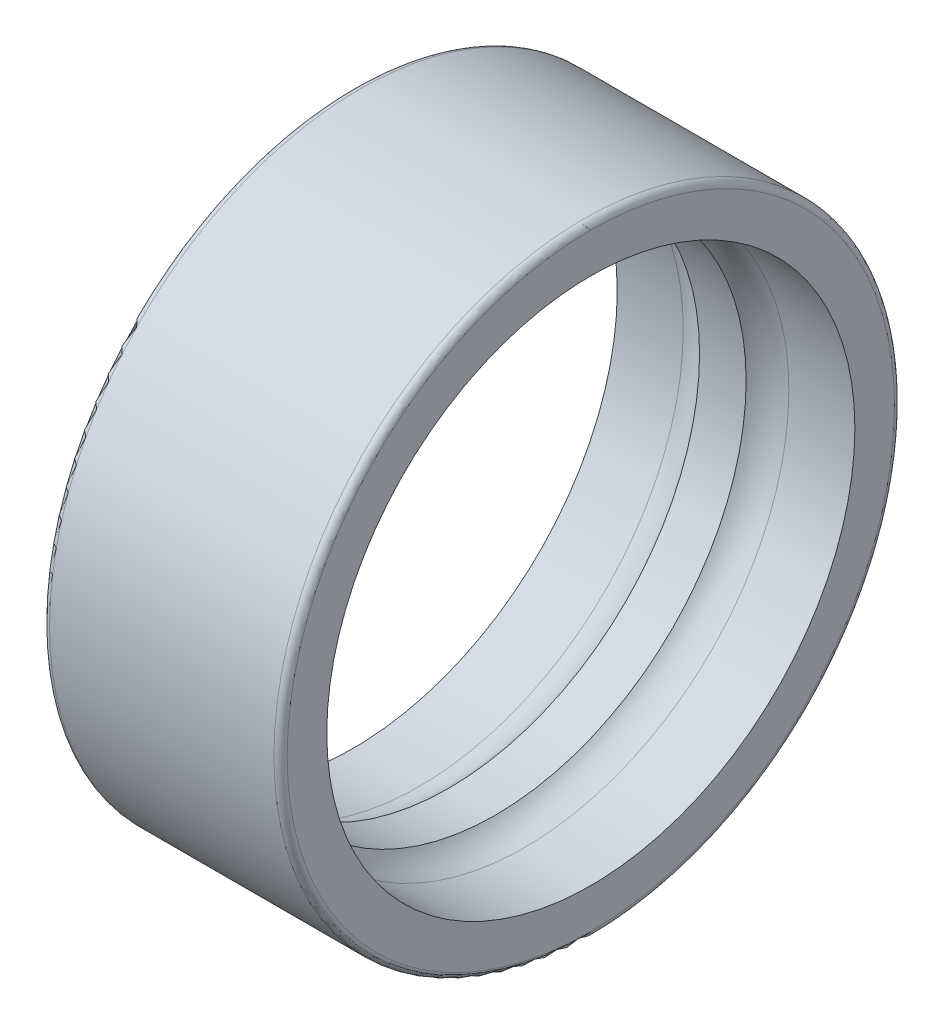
SolidWorks part; units mm, degrees
ref_plane "Plan de face" through (0, 0, 0) normal (0, 0, 1) x (1, 0, 0)
ref_plane "Plan de dessus" through (0, 0, 0) normal (0, 1, 0) x (1, 0, 0)
ref_plane "Plan de droite" through (0, 0, 0) normal (1, 0, 0) x (0, 0, -1)
sketch "Esquisse1" plane through (0, 0, 0) normal (0, 0, 1) x (1, 0, 0)
  line L0 (0, 20) -> (0, 23.5)
  line L1 (0, 23.5) -> (18, 23.5)
  line L2 (18, 23.5) -> (18, 20)
  line L3 (10.7639, 19) -> (7.2361, 19)
  line L4 (5, 20) -> (0, 20)
  line L5 (13, 20) -> (18, 20)
  line L6 (-1.4396, 0) -> (20.4031, 0) construction
  arc A0 (7.2361, 19) -> (5, 20) centre (5, 17) ccw
  arc A1 (13, 20) -> (10.7639, 19) centre (13, 17) ccw
  dimension "D1" = 3
  dimension "D4" = 5
  dimension "D2" = 6.5
  dimension "D3" = 18
  dimension "D5" = 47
  dimension "D6" = 1
revolve "Révolution1" add sketch "Esquisse1" angle 360 about L6
fillet "Congé1" radius 0.5 2 edges at (0, 0, 23.5) (18, 0, 23.5)
